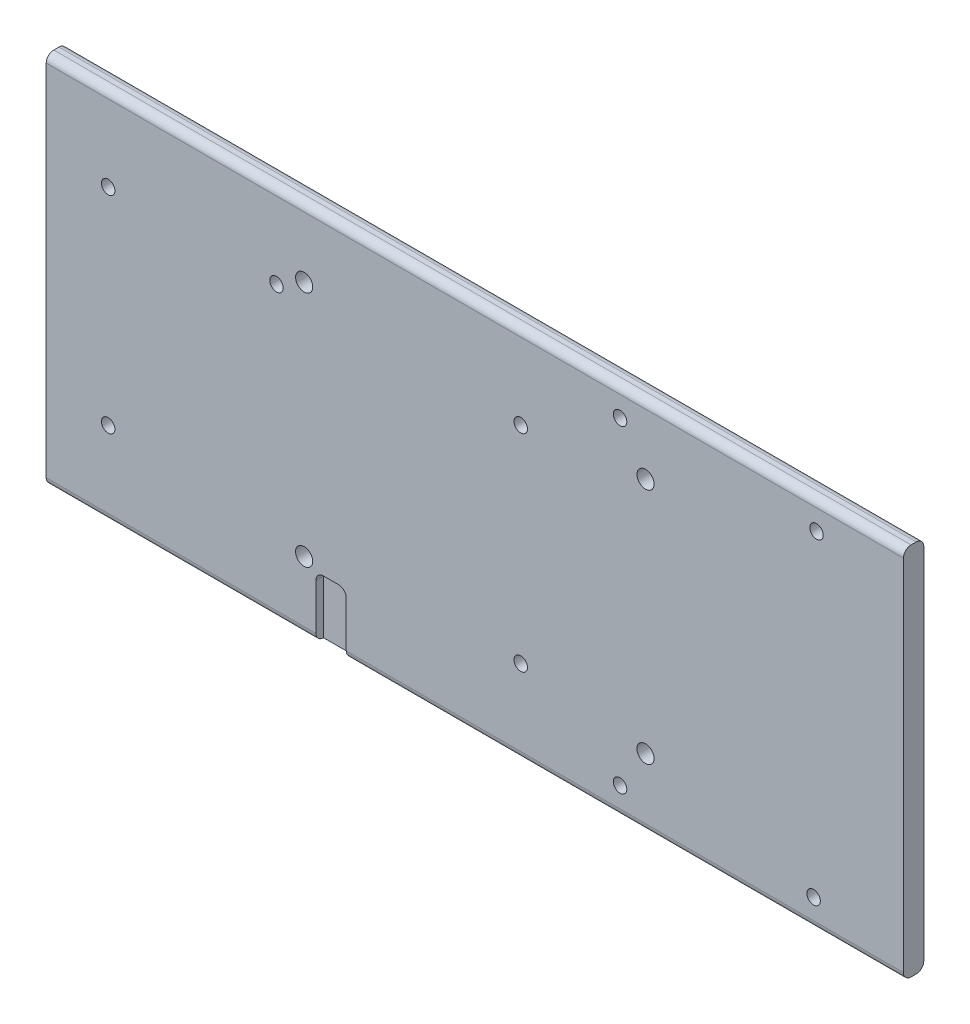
SolidWorks part; units mm, degrees
ref_plane "Front Plane" through (0, 0, 0) normal (0, 0, 1) x (1, 0, 0)
ref_plane "Top Plane" through (0, 0, 0) normal (0, 1, 0) x (1, 0, 0)
ref_plane "Right Plane" through (0, 0, 0) normal (1, 0, 0) x (0, 0, -1)
sketch "Sketch1" plane through (0, 0, 0) normal (0, 0, 1) x (1, 0, 0)
  line L1 (0, 0) -> (101, 0)
  line L2 (0, 0) -> (0, 37.32)
  line L3 (0, 37.32) -> (101, 37.32)
  line L4 (101, 0) -> (101, 37.32)
  dimension "D1" = 101
  dimension "D2" = 37.32
extrude "Extrude1" add sketch "Sketch1" along normal blind 2.68
sketch "Sketch2" plane through (0, 0, 2.68) normal (0, 0, 1) x (1, 0, 0)
  line L0 (0, 0) -> (101, 0) construction
  line L1 (101, 37.32) -> (0, 37.32) construction
  line L4 (101, 0) -> (101, 37.32) construction
  circle A0 centre (2, 35.32) radius 1.13
  circle A2 centre (2, 2) radius 1.13
  circle A4 centre (38, 35.32) radius 1.13
  circle A5 centre (38, 2) radius 1.13
  circle A6 centre (47, 25.95) radius 1.13
  circle A7 centre (99, 25.95) radius 1.13
  circle A8 centre (47, 4.95) radius 1.13
  circle A9 centre (99, 4.95) radius 1.13
  dimension "D1" = 2
  dimension "D3" = 36
  dimension "D4" = 36
  dimension "D5" = 11.37
  dimension "D11" = 11.37
  dimension "D6" = 2
  dimension "D7" = 2
  dimension "D8" = 52
  dimension "D9" = 52
  dimension "D10" = 4.95
extrude "Cut-Extrude1" [suppressed] cut sketch "Sketch2" against normal through all
sketch "Sketch5" plane through (0, 0, 0) normal (0, 0, -1) x (-1, 0, 0)
  line L0 (-50.5, 31.16) -> (-50.5, 6.16) construction
  line L1 (-25.5, 6.16) -> (-75.5, 6.16) construction
  line L2 (-25.5, 6.16) -> (-25.5, 31.16) construction
  line L3 (-25.5, 31.16) -> (-75.5, 31.16) construction
  line L4 (-75.5, 6.16) -> (-75.5, 31.16) construction
  line L5 (0, 37.32) -> (0, 0) construction
  line L6 (-25.5, 18.66) -> (-75.5, 18.66) construction
  line L7 (0, 0) -> (-101, 0) construction
  line L8 (-101, 37.32) -> (0, 37.32) construction
  line L10 (-101, 0) -> (-101, 37.32) construction
  circle A0 centre (-28, 3) radius 1.1303
  circle A1 centre (-28, 34.32) radius 1.1303
  circle A2 centre (-73, 34.32) radius 1.1303
  circle A3 centre (-73, 3) radius 1.1303
  point P6 (0, 18.66)
  point P25 (-50.5, 18.66)
  dimension "D5" = 3
  dimension "D13" = 22.5
  dimension "D10" = 28
  dimension "D11" = 31.32
  dimension "D1" = 50
  dimension "D2" = 28
  dimension "D3" = 50.5
  dimension "D4" = 25
  dimension "D6" = 3
  dimension "D7" = 3
  dimension "D8" = 3
  dimension "D9" = 28
  dimension "D12" = 45
  dimension "D14" = 15.66
extrude "Cut-Extrude3" cut sketch "Sketch5" against normal through all
sketch "Sketch8" plane through (0, 0, 2.68) normal (0, 0, 1) x (1, 0, 0)
  line L1 (107, -6) -> (-6, -6)
  line L2 (107, -6) -> (107, 43.32)
  line L3 (107, 43.32) -> (-6, 43.32)
  line L4 (-6, -6) -> (-6, 43.32)
  line L5 (101, 37.32) -> (0, 37.32) construction
  line L6 (0, 37.32) -> (0, 0) construction
  line L8 (101, 0) -> (0, 0)
  line L9 (101, 0) -> (101, 37.32)
  line L10 (101, 37.32) -> (0, 37.32)
  line L11 (0, 0) -> (0, 37.32)
  dimension "D1" = 113
  dimension "D2" = 49.32
  dimension "D3" = 6
  dimension "D4" = 6
sketch "Sketch10" plane through (0, 0, 2.68) normal (0, 0, 1) x (1, 0, 0)
  line L0 (107, -6) -> (-6, -6)
  line L1 (107, -6) -> (107, 43.32)
  line L2 (107, 43.32) -> (-6, 43.32)
  line L3 (-6, -6) -> (-6, 43.32)
  line L4 (101, 0) -> (0, 0)
  line L5 (101, 0) -> (101, 37.32)
  line L6 (101, 37.32) -> (0, 37.32)
  line L7 (0, 0) -> (0, 37.32)
extrude "Extrude2" add sketch "Sketch10" against normal up to surface (2.68 mm away)
sketch "Sketch4" [suppressed] plane through (0, 0, 4) normal (0, 0, 1) x (1, 0, 0)
  circle A0 centre (47, 25.95) radius 2.5
  circle A1 centre (99, 4.95) radius 2.5
  circle A2 centre (47, 4.95) radius 2.5
  circle A3 centre (99, 25.95) radius 2.5
  circle A4 centre (38, 2) radius 2.5
  circle A5 centre (2, 2) radius 2.5
  circle A6 centre (2, 35.32) radius 2.5
  circle A7 centre (38, 35.32) radius 2.5
extrude "Cut-Extrude2" [suppressed] cut sketch "Sketch4" against normal blind 2
sketch "Sketch11" plane through (0, 0, 2.68) normal (0, 0, 1) x (1, 0, 0)
  line L0 (101, 0) -> (101, 37.32) construction
  line L1 (101, 0) -> (0, 0) construction
  line L2 (0, 0) -> (0, 37.32) construction
  line L3 (101, 37.32) -> (0, 37.32) construction
  line L4 (101, 0) -> (101, 37.32) construction
  line L5 (101, 0) -> (0, 0) construction
  line L6 (0, 0) -> (0, 37.32) construction
  line L7 (101, 37.32) -> (0, 37.32) construction
sketch "Sketch12" plane through (0, 0, 0) normal (0, 0, -1) x (-1, 0, 0)
  circle A4 centre (-69.641, 39.6358) radius 0.889
  circle A5 centre (-2.164, 5.05) radius 0.889
  circle A6 centre (-56.55, 5.05) radius 0.889
  circle A7 centre (-56.55, 32.27) radius 0.889
  circle A8 centre (-95.5375, 39.6358) radius 0.889
  circle A9 centre (-2.164, 32.27) radius 0.889
  circle A10 centre (-24.355, 32.27) radius 0.889
  circle A11 centre (-95.1549, -2.3158) radius 0.889
  circle A12 centre (-69.641, -2.3158) radius 0.889
extrude "Cut-Extrude4" cut sketch "Sketch12" against normal through all
fillet "Fillet2" radius 1 1 edges at (50.5, 43.32, 2.68)
fillet "Fillet3" radius 1 1 edges at (50.5, -6, 2.68)
fillet "Fillet4" radius 1 1 edges at (50.5, -6, 0)
fillet "Fillet5" radius 1 1 edges at (50.5, 43.32, 0)
sketch "Sketch13" plane through (0, 0, 2.68) normal (0, 0, 1) x (1, 0, 0)
  line L3 (33.55, 1.05) -> (33.55, -2)
  line L4 (29.55, -2) -> (29.55, 1.05)
  line L5 (30.55, 2.05) -> (32.55, 2.05)
  line L6 (29.55, -2) -> (29.55, -5)
  line L7 (-6, -5) -> (107, -5) construction
  line L9 (33.55, -5) -> (33.55, -2)
  line L12 (29.55, -5) -> (29.55, -6.5267)
  line L13 (29.55, -6.5267) -> (33.55, -6.5267)
  line L14 (33.55, -5) -> (33.55, -6.5267)
  arc A2 (33.55, 1.05) -> (32.55, 2.05) centre (32.55, 1.05) ccw
  arc A3 (30.55, 2.05) -> (29.55, 1.05) centre (30.55, 1.05) ccw
extrude "Cut-Extrude5" cut sketch "Sketch13" against normal blind 1
sketch "Sketch14" plane through (0, 0, 0) normal (0, 0, 1) x (1, 0, 0)
  line L0 (107, 43.32) -> (-6, 43.32) construction
  line L3 (107, -6) -> (-6, -6) construction
  line L4 (107, -6) -> (-6, -6) construction
  line L5 (107, 43.32) -> (-6, 43.32) construction
  line L6 (107, -6) -> (107, 43.32) construction
  line L7 (-6, -6) -> (-6, 43.32) construction
  line L8 (-6, 43.32) -> (107, 43.32) construction
  circle A0 centre (28, 34.32) radius 1.1303 construction
  circle A1 centre (28, 3) radius 1.1303 construction
  circle A2 centre (73, 34.32) radius 1.1303 construction
  circle A3 centre (73, 3) radius 1.1303 construction
  circle A4 centre (28, 3) radius 1.1303 construction
  circle A5 centre (73, 34.32) radius 1.1303 construction
  circle A6 centre (73, 3) radius 1.1303 construction
  circle A7 centre (28, 34.32) radius 1.1303 construction
  dimension "D1" = 113
  dimension "D3" = 45
  dimension "D4" = 31.32
  dimension "D2" = 49.32
  dimension "D5" = 34
  dimension "D6" = 34
  dimension "D7" = 9
  dimension "D8" = 9
